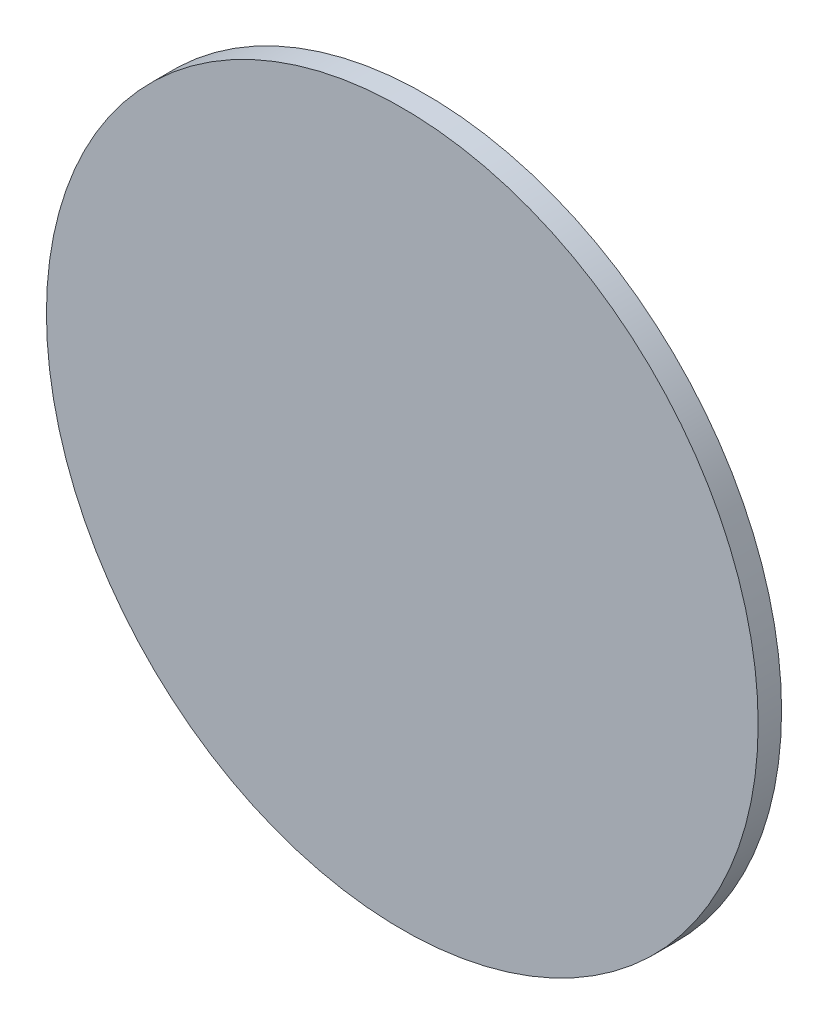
SolidWorks part; units mm, degrees
ref_plane "Alzado" through (0, 0, 0) normal (0, 0, 1) x (1, 0, 0)
ref_plane "Planta" through (0, 0, 0) normal (0, 1, 0) x (1, 0, 0)
ref_plane "Vista lateral" through (0, 0, 0) normal (1, 0, 0) x (0, 0, -1)
sketch "Croquis1" plane through (0, 0, 0) normal (0, 0, 1) x (1, 0, 0)
  circle A0 centre (0, 0) radius 76
extrude "Saliente-Extruir1" add sketch "Croquis1" along normal blind 5
